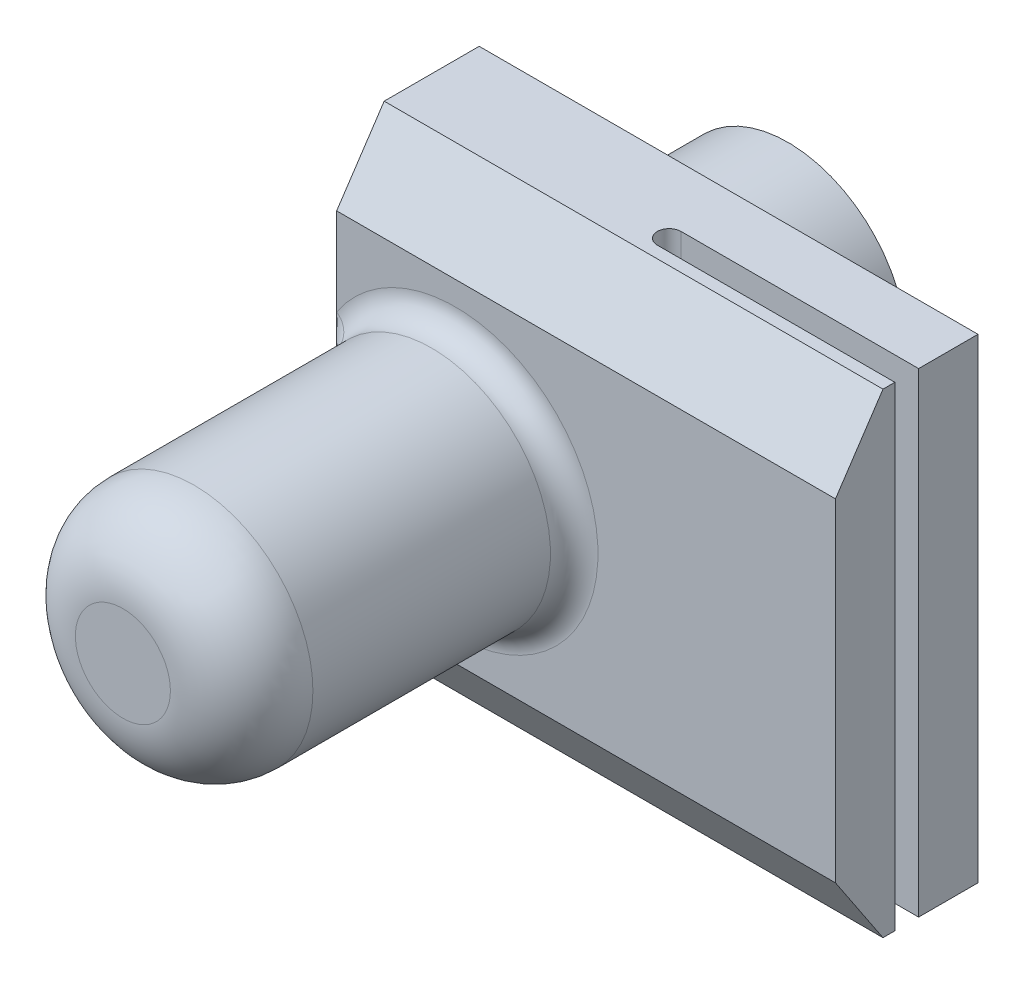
SolidWorks part; units mm, degrees
ref_plane "Front Plane" through (0, 0, 0) normal (0, 0, 1) x (1, 0, 0)
ref_plane "Top Plane" through (0, 0, 0) normal (0, 1, 0) x (1, 0, 0)
ref_plane "Right Plane" through (0, 0, 0) normal (1, 0, 0) x (0, 0, -1)
sketch "Sketch1" plane through (0, 0, 0) normal (0, 0, 1) x (1, 0, 0)
  circle A0 centre (0, 0) radius 2.5
  dimension "D1" = 5
extrude "Extrude1" add sketch "Sketch1" along normal blind 4
fillet "Fillet1" radius 1.5 1 edges at (2.5, 0, 4)
sketch "Sketch2" plane through (0, 0, 0) normal (0, 0, -1) x (-1, 0, 0)
  circle A0 centre (0, 0) radius 2.5
  dimension "D1" = 5
extrude "Extrude2" add sketch "Sketch2" along normal blind 10
ref_plane "Plane1" through (0, 0, -4.5) normal (0, 0, -1) x (-1, 0, 0)
sketch "Sketch3" plane through (0, 0, -4.5) normal (0, 0, -1) x (-1, 0, 0)
  line L1 (-8, 0) -> (2.5, 0)
  line L2 (-8, 0) -> (-8, -5)
  line L3 (-8, -5) -> (2.5, -5)
  line L4 (2.5, 0) -> (2.5, -5)
  circle A0 centre (0, 0) radius 2.5 construction
  dimension "D1" = 10.5
  dimension "D2" = 5
extrude "Extrude3" add sketch "Sketch3" against normal mid plane 3
sketch "Sketch4" plane through (0, 0, 0) normal (0, 1, 0) x (-1, 0, 0)
  line L0 (-8, -3) -> (-8, -6) construction
  line L1 (-8, -4.25) -> (-3, -4.25)
  line L2 (-8, -4.25) -> (-8, -4.75)
  line L3 (-8, -4.75) -> (-3, -4.75)
  line L5 (0, -4.5) -> (-8, -4.5) construction
  line L6 (-2.75, -4.5) -> (2.75, -4.5) construction
  arc A0 (-3, -4.25) -> (-3, -4.75) centre (-3, -4.5) cw
  dimension "D1" = 0.5
  dimension "D2" = 5
extrude "Cut-Extrude1" cut sketch "Sketch4" against normal through all
ref_plane "Plane2" through (0, 2.5, 0) normal (0, 1, 0) x (-1, 0, 0)
mirror "Mirror1" about plane through (0, 0, 0) normal (0, 1, 0) of "Extrude3", "Cut-Extrude1"
fillet "Fillet2" radius 0.5 2 edges at (-2.5, 0, -6) (-2.5, 0, -3)
chamfer "Chamfer1" distance 1 distance2 1.5 1 edges at (2.75, 5, -3)
chamfer "Chamfer2" distance 1.5 distance2 1 1 edges at (2.75, -5, -3)
